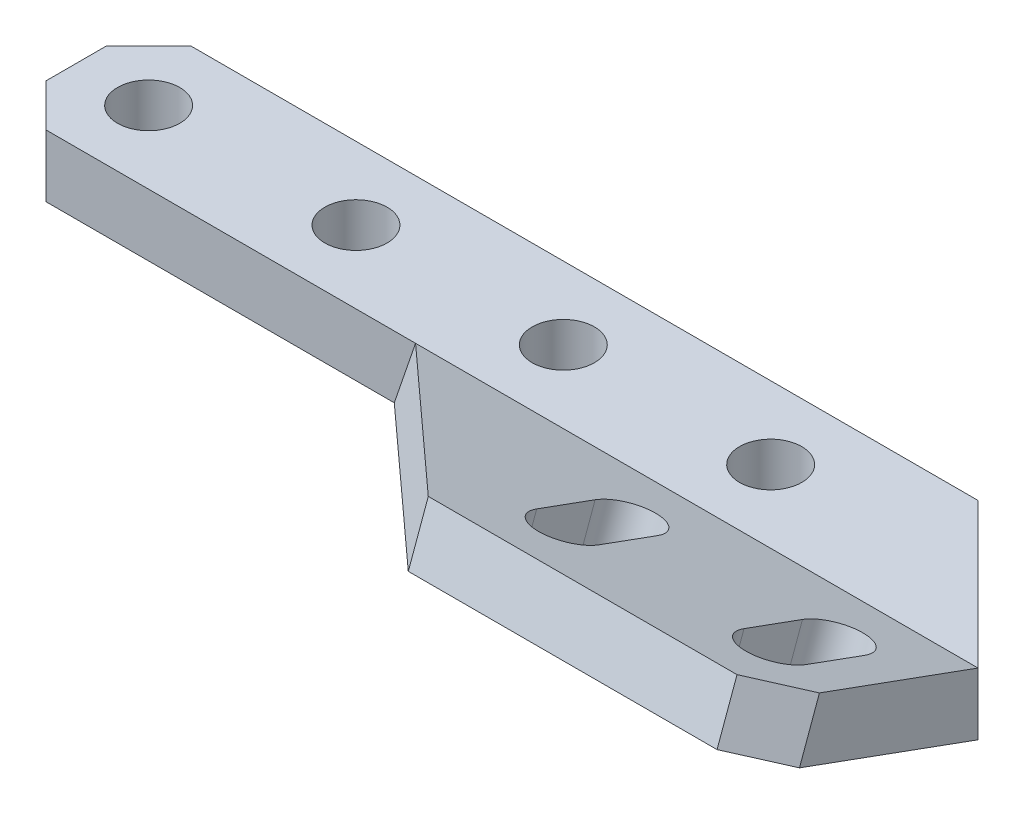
SolidWorks part; units mm, degrees
ref_plane "Front" through (0, 0, 0) normal (0, 0, 1) x (1, 0, 0)
ref_plane "Top" through (0, 0, 0) normal (0, 1, 0) x (1, 0, 0)
ref_plane "Right" through (0, 0, 0) normal (1, 0, 0) x (0, 0, -1)
sketch "Esquisse1" plane through (0, 0, 0) normal (0, 1, 0) x (1, 0, 0)
  line L1 (-1.4497, 3.5) -> (-3.5, 1.4497)
  line L2 (-3.5, 1.4497) -> (-3.5, -1.4497)
  line L3 (-3.5, -1.4497) -> (-1.4497, -3.5)
  line L4 (-1.4497, -3.5) -> (1.4497, -3.5)
  line L5 (1.4497, -3.5) -> (3.5, -1.4497)
  line L6 (3.5, -1.4497) -> (3.5, 1.4497)
  line L7 (3.5, 1.4497) -> (1.4497, 3.5)
  line L8 (1.4497, 3.5) -> (-1.4497, 3.5)
  line L9 (28.5503, 3.5) -> (26.5, 1.4497)
  line L10 (26.5, 1.4497) -> (26.5, -1.4497)
  line L11 (26.5, -1.4497) -> (28.5503, -3.5)
  line L12 (28.5503, -3.5) -> (31.4497, -3.5)
  line L13 (31.4497, -3.5) -> (33.5, -1.4497)
  line L14 (33.5, -1.4497) -> (33.5, 1.4497)
  line L15 (33.5, 1.4497) -> (31.4497, 3.5)
  line L16 (31.4497, 3.5) -> (28.5503, 3.5)
  circle A0 centre (0, 0) radius 1.5
  circle A1 centre (0, 0) radius 3.5 construction
  circle A2 centre (10, 0) radius 1.5
  circle A3 centre (20, 0) radius 1.5
  circle A4 centre (30, 0) radius 1.5
  circle A5 centre (30, 0) radius 3.5 construction
  dimension "D1" = 3
  dimension "D2" = 7
  dimension "D4" = 10
  dimension "D3" = 4
sketch "Esquisse2" plane through (0, 0, 0) normal (1, 0, 0) x (0, 0, -1)
  line L0 (3.5, 0) -> (-3.5, 0)
  line L1 (-3.5, 0) -> (-22.2939, 6.8404)
  dimension "D1" = 20
  dimension "D2" = 20
ref_plane "Plan1" through (0, -1.1249, 0.4094) normal (0, 0.9397, -0.342) x (1, 0, 0)
sketch "Esquisse3" plane through (0, 0, 0) normal (0, 1, 0) x (1, 0, 0)
  line L1 (33.5, -1.4497) -> (33.5, 1.4497) construction
  line L2 (33.5, 1.4497) -> (31.4497, 3.5) construction
  line L7 (33.5, -1.4497) -> (33.5, 1.4497)
  line L8 (33.5, 1.4497) -> (31.4497, 3.5)
  line L11 (-6.5, 3.5) -> (-13.5, -3.5)
  line L12 (-6.5, 3.5) -> (31.4497, 3.5)
  line L13 (-13.5, -3.5) -> (31.4497, -3.5)
  line L14 (-1.4497, -3.5) -> (1.4497, -3.5) construction
  line L15 (31.4497, -3.5) -> (33.5, -1.4497) construction
  line L16 (31.4497, -3.5) -> (33.5, -1.4497)
  line L17 (-1.4497, 3.5) -> (-3.5, 1.4497) construction
  circle A0 centre (30, 0) radius 1.5 construction
  circle A1 centre (30, 0) radius 1.5
  circle A2 centre (20, 0) radius 1.5 construction
  circle A3 centre (20, 0) radius 1.5
  circle A4 centre (10, 0) radius 1.5 construction
  circle A5 centre (10, 0) radius 1.5
  circle A6 centre (0, 0) radius 1.5 construction
  circle A7 centre (0, 0) radius 1.5
  dimension "D1" = 13.5
extrude "Boss.-Extru.1" add sketch "Esquisse3" along normal blind 3
sketch "Esquisse4" plane through (0, -1.1249, 0.4094) normal (0, 0.9397, -0.342) x (1, 0, 0)
  line L0 (14.1214, -3.8202) -> (3.1903, -14.7513)
  line L1 (-13.5, -4.315) -> (31.4497, -4.315) construction
  line L2 (0, -8.0017) -> (0, -11.0017) construction
  line L3 (0, -3.2889) -> (0, -23.2889) construction
  line L4 (1.5, -8.0017) -> (1.5, -11.0017)
  line L5 (-1.5, -8.0017) -> (-1.5, -11.0017)
  line L6 (-11.5, -8.0017) -> (-11.5, -11.0017)
  line L7 (-8.5, -8.0017) -> (-8.5, -11.0017)
  line L8 (-10, -8.0017) -> (-10, -11.0017) construction
  line L10 (-13.5, -12.4514) -> (-11.4497, -14.5017)
  line L11 (-11.4497, -14.5017) -> (-8.5503, -14.5017)
  line L12 (-8.5503, -14.5017) -> (-6.5, -12.4514)
  line L13 (-6.5, -12.4514) -> (-6.5, -9.5519)
  line L14 (-6.5, -9.5519) -> (-8.5503, -7.5017)
  line L15 (-8.5503, -7.5017) -> (-11.4497, -7.5017)
  line L16 (-11.4497, -7.5017) -> (-13.5, -9.5519)
  line L17 (-13.5, -9.5519) -> (-13.5, -12.4514)
  arc A0 (1.5, -8.0017) -> (-1.5, -8.0017) centre (0, -8.0017) ccw
  arc A1 (-1.5, -11.0017) -> (1.5, -11.0017) centre (0, -11.0017) ccw
  arc A2 (-8.5, -8.0017) -> (-11.5, -8.0017) centre (-10, -8.0017) ccw
  arc A3 (-11.5, -11.0017) -> (-8.5, -11.0017) centre (-10, -11.0017) ccw
  circle A4 centre (-10, -11.0017) radius 3.5 construction
  ellipse E0 centre (20, 0) end of major axis (18.5, 0) minor radius 1.4095 construction
  point P14 (0, -9.5017)
  point P22 (-10, -9.5017)
  dimension "D5" = 1.5
  dimension "D7" = 7
  dimension "D1" = 45
  dimension "D3" = 8.0017
  dimension "D4" = 3
  dimension "D6" = 10
  dimension "D2" = 2
sketch "Esquisse5" plane through (0, -1.1249, 0.4094) normal (0, 0.9397, -0.342) x (1, 0, 0)
  line L0 (14.1214, -3.8202) -> (3.1903, -14.7513) construction
  line L1 (-13.5, -12.4514) -> (-11.4497, -14.5017) construction
  line L2 (-13.5, -9.5519) -> (-13.5, -12.4514) construction
  line L3 (14.6527, -3.2889) -> (3.44, -14.5017)
  line L4 (-13.5, -12.4514) -> (-11.4497, -14.5017)
  line L5 (-13.5, -3.2889) -> (-13.5, -12.4514)
  line L6 (-1.5, -8.0017) -> (-1.5, -11.0017) construction
  line L7 (1.5, -8.0017) -> (1.5, -11.0017) construction
  line L8 (-1.5, -8.0017) -> (-1.5, -11.0017)
  line L9 (1.5, -8.0017) -> (1.5, -11.0017)
  line L10 (-11.5, -8.0017) -> (-11.5, -11.0017) construction
  line L11 (-8.5, -8.0017) -> (-8.5, -11.0017) construction
  line L12 (-8.5, -8.0017) -> (-8.5, -11.0017)
  line L13 (-11.5, -8.0017) -> (-11.5, -11.0017)
  line L14 (-13.5, -3.2889) -> (31.4497, -3.2889) construction
  line L15 (-13.5, -3.2889) -> (14.6527, -3.2889)
  line L16 (-11.4497, -14.5017) -> (-8.5503, -14.5017) construction
  line L17 (-11.4497, -14.5017) -> (3.44, -14.5017)
  arc A0 (1.5, -8.0017) -> (-1.5, -8.0017) centre (0, -8.0017) ccw construction
  arc A1 (-1.5, -11.0017) -> (1.5, -11.0017) centre (0, -11.0017) ccw construction
  arc A2 (1.5, -8.0017) -> (-1.5, -8.0017) centre (0, -8.0017) ccw
  arc A3 (-1.5, -11.0017) -> (1.5, -11.0017) centre (0, -11.0017) ccw
  arc A4 (-8.5, -8.0017) -> (-11.5, -8.0017) centre (-10, -8.0017) ccw construction
  arc A5 (-11.5, -11.0017) -> (-8.5, -11.0017) centre (-10, -11.0017) ccw construction
  arc A6 (-8.5, -8.0017) -> (-11.5, -8.0017) centre (-10, -8.0017) ccw
  arc A7 (-11.5, -11.0017) -> (-8.5, -11.0017) centre (-10, -11.0017) ccw
extrude "Boss.-Extru.2" add sketch "Esquisse5" along normal up to vertex (2.8191 mm away)
sketch "Esquisse6" plane through (-5, 0, -5) normal (-0.7071, 0, -0.7071) x (-0.7071, 0, 0.7071)
  circle A0 centre (10.1981, -0.2623) radius 9.4786
extrude "Enlèv. mat.-Extru.1" cut sketch "Esquisse6" along normal through all
mirror "Symétrie1" about plane through (0, 0, 0) normal (1, 0, 0)
delete or keep bodies "Corps-Supprimer/Garder 1" type keep bodies bodies 104
